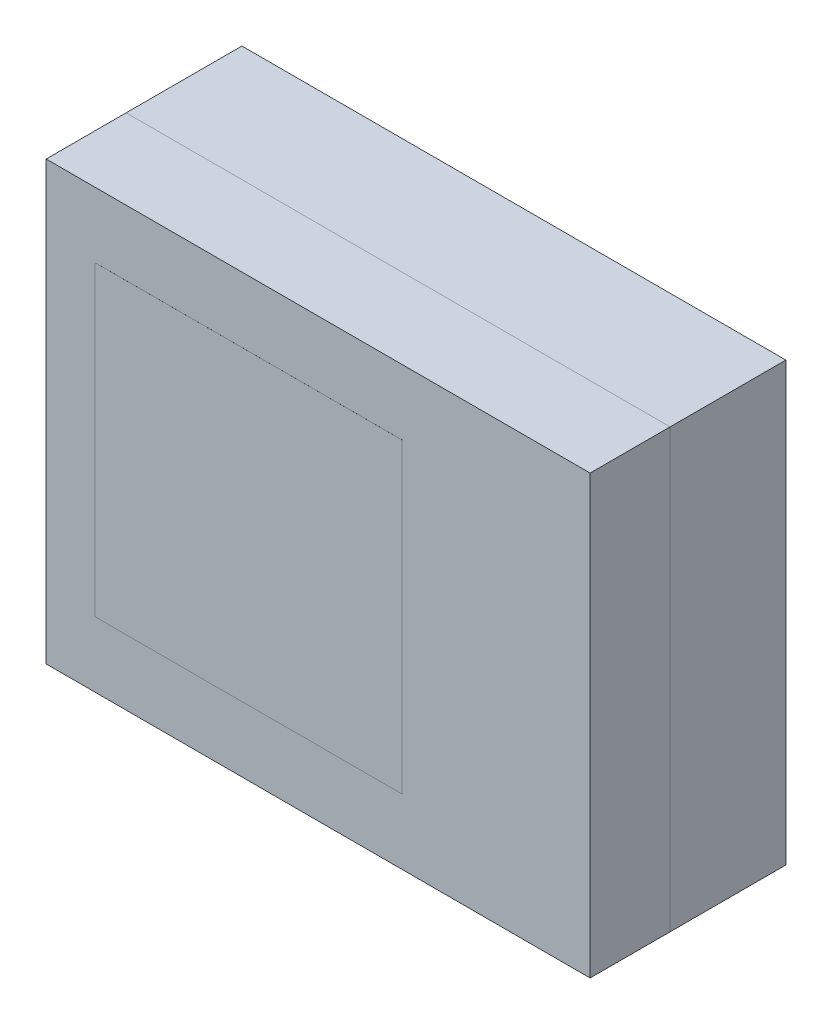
SolidWorks part; units mm, degrees
ref_plane "前视基准面" through (0, 0, 0) normal (0, 0, 1) x (1, 0, 0)
ref_plane "上视基准面" through (0, 0, 0) normal (0, 1, 0) x (1, 0, 0)
ref_plane "右视基准面" through (0, 0, 0) normal (1, 0, 0) x (0, 0, -1)
sketch "草图1" plane through (0, 0, 0) normal (0, 0, 1) x (1, 0, 0)
  line L1 (-0.575, -0.575) -> (0.575, -0.575)
  line L2 (-0.575, -0.575) -> (-0.575, 0.575)
  line L3 (-0.575, 0.575) -> (0.575, 0.575)
  line L4 (0.575, -0.575) -> (0.575, 0.575)
  line L5 (-0.575, -0.575) -> (0.575, 0.575) construction
  line L6 (-0.575, 0.575) -> (0.575, -0.575) construction
  point P1 (0, 0)
  dimension "D1" = 1.15
  dimension "D2" = 1.15
extrude "凸台-拉伸1" add sketch "草图1" along normal blind 0.0001
sketch "草图6" plane through (0, 0, 0) normal (0, 0, -1) x (-1, 0, 0)
  line L0 (0.575, -0.575) -> (-0.575, -0.575) construction
  line L1 (0.759, -0.82) -> (-1.281, -0.82)
  line L2 (0.759, -0.82) -> (0.759, 0.82)
  line L3 (0.759, 0.82) -> (-1.281, 0.82)
  line L4 (-1.281, -0.82) -> (-1.281, 0.82)
  line L5 (0.759, -0.82) -> (-1.281, 0.82) construction
  line L6 (0.759, 0.82) -> (-1.281, -0.82) construction
  line L7 (0.575, 0.575) -> (0.575, -0.575) construction
  point P0 (-0.261, 0)
  dimension "D1" = 2.04
  dimension "D2" = 1.64
  dimension "D3" = 0.245
  dimension "D4" = 0.184
extrude "凸台-拉伸5" add sketch "草图6" along normal blind 0.3 separate body
sketch "草图7" plane through (0, 0, -0.3) normal (0, 0, -1) x (-1, 0, 0)
  line L0 (-1.281, 0.82) -> (-1.281, -0.82) construction
  line L1 (0.759, -0.82) -> (-1.281, -0.82)
  line L2 (0.759, -0.82) -> (0.759, 0.82)
  line L3 (0.759, 0.82) -> (-1.281, 0.82)
  line L4 (-1.281, -0.82) -> (-1.281, 0.82)
  line L5 (0.759, -0.82) -> (-1.281, 0.82) construction
  line L6 (0.759, 0.82) -> (-1.281, -0.82) construction
  line L7 (0.759, 0.82) -> (-1.281, 0.82) construction
  point P0 (-0.261, 0)
  point P9 (0, 0)
  point P10 (0, 0)
  point P11 (0.759, -0.82)
extrude "凸台-拉伸6" add sketch "草图7" along normal blind 0.434 separate body
sketch "草图8" plane through (0, 0, -0.734) normal (0, 0, -1) x (-1, 0, 0)
  line L1 (0.609, -0.67) -> (0.009, -0.67)
  line L2 (0.609, -0.67) -> (0.609, 0.67)
  line L3 (0.609, 0.67) -> (0.009, 0.67)
  line L4 (0.009, -0.67) -> (0.009, 0.67)
  line L5 (0.609, -0.67) -> (0.009, 0.67) construction
  line L6 (0.609, 0.67) -> (0.009, -0.67) construction
  line L7 (0.295, 0.924) -> (-0.575, 0.924)
  line L11 (0.4038, 0) -> (-0.4038, 0) construction
  line L12 (-0.261, 0.125) -> (-0.261, 0.67)
  line L13 (0.759, -0.82) -> (0.759, 0.82) construction
  line L14 (-0.261, -0.125) -> (-1.131, -0.125)
  line L15 (-0.261, -0.125) -> (-0.261, -0.67)
  line L16 (-0.261, -0.67) -> (-1.131, -0.67)
  line L17 (-1.131, -0.125) -> (-1.131, -0.67)
  line L18 (-0.261, -0.125) -> (-1.131, -0.67) construction
  line L19 (-0.261, -0.67) -> (-1.131, -0.125) construction
  line L20 (0.759, 0.82) -> (-1.281, 0.82) construction
  line L21 (-1.281, 0.82) -> (-1.281, -0.82) construction
  line L23 (-0.261, 0.67) -> (-1.131, 0.67)
  line L24 (-1.131, 0.125) -> (-1.131, 0.67)
  line L25 (-0.261, 0.125) -> (-1.131, 0.125)
  line L26 (-1.281, -0.82) -> (0.759, -0.82) construction
  point P0 (0.309, 0)
  point P5 (-0.14, 0.6515)
  point P12 (-0.696, -0.3975)
  dimension "D1" = 0.87
  dimension "D2" = 0.15
  dimension "D3" = 0.545
  dimension "D5" = 0.6
  dimension "D6" = 1.34
  dimension "D7" = 0.15
  dimension "D8" = 0.15
  dimension "D9" = 0.15
extrude "凸台-拉伸7" add sketch "草图8" along normal blind 0.056 contours L4 L3 L2 L1 | L14 L17 L16 L15 | L25 L24 L23 L12
